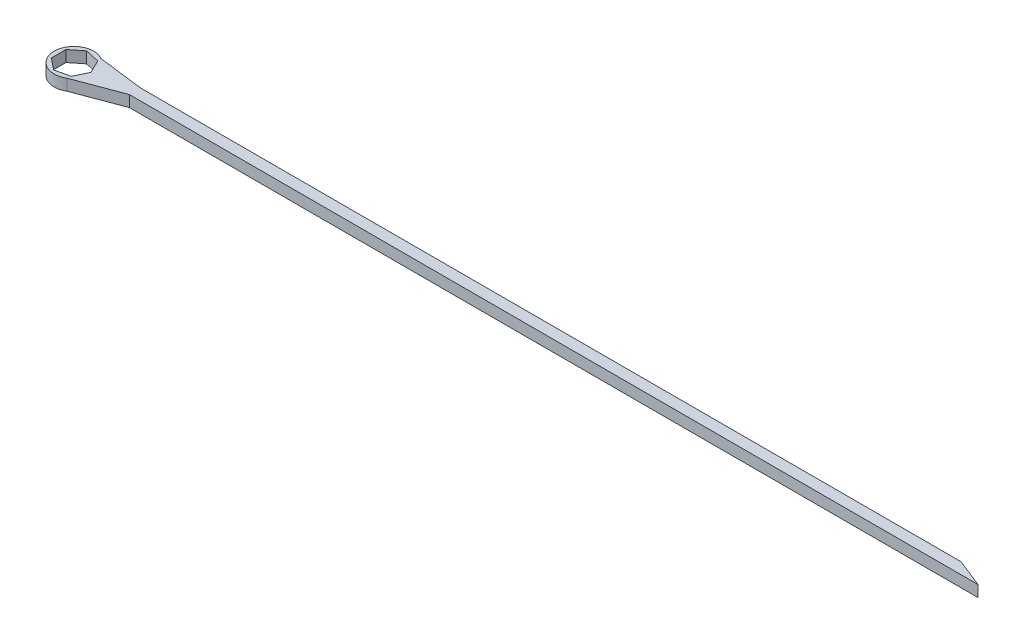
SolidWorks part; units mm, degrees
ref_plane "Front Plane" through (0, 0, 0) normal (0, 0, 1) x (1, 0, 0)
ref_plane "Top Plane" through (0, 0, 0) normal (0, 1, 0) x (1, 0, 0)
ref_plane "Right Plane" through (0, 0, 0) normal (1, 0, 0) x (0, 0, -1)
sketch "Sketch1" plane through (0, 0, 0) normal (0, 1, 0) x (1, 0, 0)
  line L0 (4.9014, 0) -> (80, 0)
  line L2 (1.5, 0) -> (0.9352, 1.1727)
  line L3 (0.9352, 1.1727) -> (-0.3338, 1.4624)
  line L4 (-0.3338, 1.4624) -> (-1.3515, 0.6508)
  line L5 (-1.3515, 0.6508) -> (-1.3515, -0.6508)
  line L6 (-1.3515, -0.6508) -> (-0.3338, -1.4624)
  line L7 (-0.3338, -1.4624) -> (0.9352, -1.1727)
  line L8 (0.9352, -1.1727) -> (1.5, 0)
  line L10 (80, 0) -> (77.5, 1)
  line L11 (77.5, 1) -> (4.9014, 1)
  line L12 (4.9014, 1) -> (0.9014, 1.5)
  line L13 (4.9014, 0) -> (0.9014, -1.5)
  arc A0 (0.9014, 1.5) -> (0.9014, -1.5) centre (0, 0) ccw
  circle A1 centre (0, 0) radius 1.5 construction
  dimension "D1" = 3.5
  dimension "D2" = 3
  dimension "D3" = 1
  dimension "D4" = 2.5
  dimension "D5" = 1.5
  dimension "D6" = 4
  dimension "D8" = 1.5
extrude "Boss-Extrude1" add sketch "Sketch1" along normal blind 1
sketch "Sketch2" plane through (0, 1, 0) normal (0, 1, 0) x (1, 0, 0)
  line L0 (0, 0) -> (16, 0)
  line L1 (4.9014, 0) -> (80, 0) construction
  line L2 (16, 0) -> (23.6429, 0)
  line L3 (23.6429, 0) -> (31.2857, 0)
  line L4 (31.2857, 0) -> (38.9286, 0)
  line L5 (38.9286, 0) -> (46.5714, 0)
  line L6 (46.5714, 0) -> (54.2143, 0)
  line L7 (54.2143, 0) -> (61.8571, 0)
  line L8 (61.8571, 0) -> (69.5, 0)
  line L10 (69.5, 0) -> (77.5, 0)
  dimension "D1" = 16
  dimension "D2" = 8
